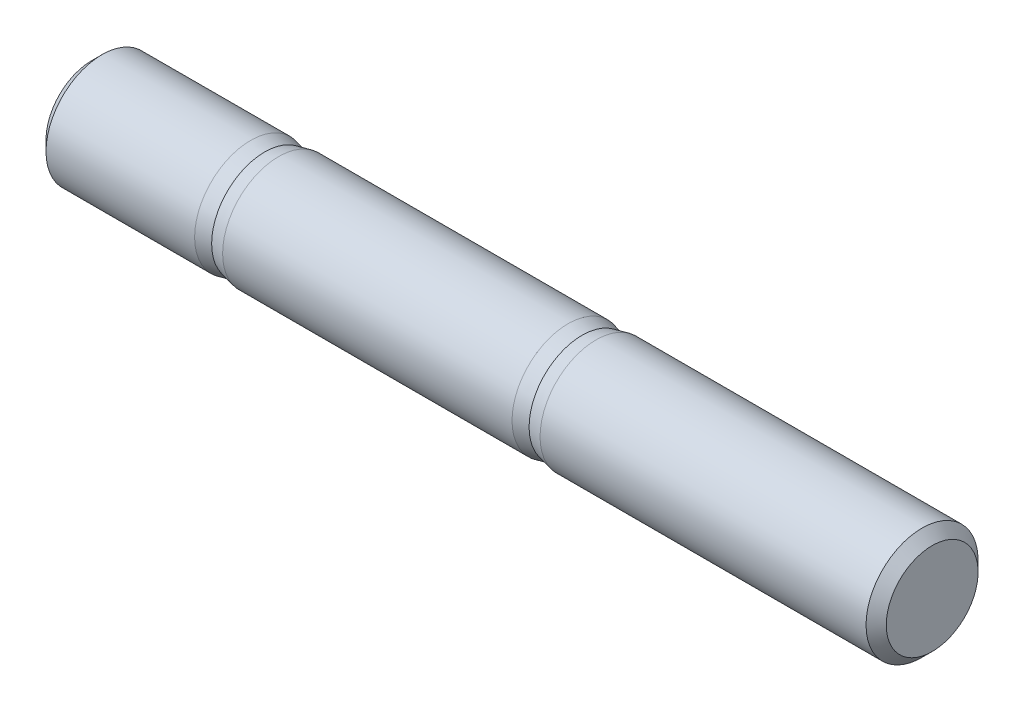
SolidWorks part; units mm, degrees
ref_plane "Front" through (0, 0, 0) normal (0, 0, 1) x (1, 0, 0)
ref_plane "Top" through (0, 0, 0) normal (0, 1, 0) x (1, 0, 0)
ref_plane "Right" through (0, 0, 0) normal (1, 0, 0) x (0, 0, -1)
other "Configuration Table"
sketch "Sketch1" plane through (0, 0, 0) normal (0, 0, 1) x (1, 0, 0)
  line L0 (-1.3108, 0) -> (30.3862, 0) construction
  line L1 (0, 0) -> (0, 3)
  line L2 (0, 3) -> (8.5, 3)
  line L3 (8.5, 3) -> (10, 2.675)
  line L4 (10, 2.675) -> (25.5, 2.675)
  line L5 (25.5, 2.675) -> (27, 3)
  line L6 (27, 3) -> (45, 3)
  line L7 (45, 3) -> (45, 0)
  line L8 (45, 0) -> (0, 0)
revolve "BaseHead" add sketch "Sketch1" angle 360 about L0
chamfer "HeadChamfer" distance 0.5415 angle 45 2 edges at (0, 0, 3) (45, 0, 3)
sketch "Sketch2" plane through (0, 0, 0) normal (0, 0, 1) x (1, 0, 0)
  line L0 (-1.3108, 0) -> (31.2107, 0) construction
  line L2 (8.5, 2.675) -> (10, 3)
  line L3 (10, 3) -> (25.5, 3)
  line L4 (25.5, 3) -> (27, 2.675)
  line L7 (8.5, 3) -> (8.5, -3) construction
  line L9 (8.5, 2.675) -> (27, 2.675)
  line L10 (27, 3) -> (27, -3) construction
revolve "BaseBody" add sketch "Sketch2" angle 360 about L0
sketch "Sketch3" plane through (0, 0, 0) normal (0, 0, 1) x (1, 0, 0)
  line L0 (44.4585, 2.531) -> (44.7293, 3)
  line L1 (44.7293, 3) -> (44.7293, 3.5)
  line L2 (44.7293, 3.5) -> (44.1878, 3.5)
  line L3 (44.1878, 3.5) -> (44.1878, 3)
  line L4 (44.1878, 3) -> (44.4585, 2.531)
  line L5 (0, 0) -> (54.5942, 0) construction
  line L6 (44.4585, 3) -> (44.4585, -3) construction
revolve "Cut-Revolve10" [suppressed] cut sketch "Sketch3" angle 360 about L5
pattern_linear "LPattern10" [suppressed] count 28 spacing 0.6498 along (1, 0, 0)
sketch "Sketch4" plane through (0, 0, 0) normal (0, 0, 1) x (1, 0, 0)
  line L0 (0.5415, 2.531) -> (0.8122, 3)
  line L1 (0.8122, 3) -> (0.8122, 3.5)
  line L2 (0.8122, 3.5) -> (0.2707, 3.5)
  line L3 (0.2707, 3.5) -> (0.2707, 3)
  line L4 (0.2707, 3) -> (0.5415, 2.531)
  line L5 (0, 0) -> (16.1581, 0) construction
  line L6 (0, 2.4585) -> (0, -2.4585) construction
  line L7 (0.5415, 3) -> (0.5415, -3) construction
revolve "Cut-Revolve11" [suppressed] cut sketch "Sketch4" angle 360 about L5
pattern_linear "LPattern11" [suppressed] count 13 spacing 0.6498 along (1, 0, 0)
equation "\"D2@Sketch1\" = \"X@Sketch1\""
equation "\"D2@ThreadCosmetic2\" = \"D2@ThreadCosmetic1\""
equation "\"D1@ThreadCosmetic1\" = \"bm@Sketch1\"-\"X@Sketch1\""
equation "\"b@ThreadCosmetic2\" = \"b@Sketch1\""
equation "\"D1@Sketch2\" = \"X@Sketch1\""
equation "\"D2@Sketch2\" = \"d@Sketch1\""
equation "\"D1@HeadChamfer\" =  ( \"d@Sketch1\" - \"D2@ThreadCosmetic1\" )  / 2"
equation "\"D5@Sketch3\" = \"d@Sketch1\""
equation "\"D4@Sketch3\" = (  \"d@Sketch1\" - \"D2@ThreadCosmetic2\" )  / 2"
equation "\"D3@LPattern10\" = \"D4@Sketch3\" * 1.2"
equation "\"D1@LPattern10\" = \"b@ThreadCosmetic2\" / \"D3@LPattern10\""
equation "\"D5@Sketch4\" = \"d@Sketch1\""
equation "\"D4@Sketch4\" = (  \"d@Sketch1\" - \"D2@ThreadCosmetic1\" )  / 2"
equation "\"D3@LPattern11\" = \"D4@Sketch4\" * 1.2"
equation "\"D1@LPattern11\" = \"D1@ThreadCosmetic1\" / \"D3@LPattern11\""
